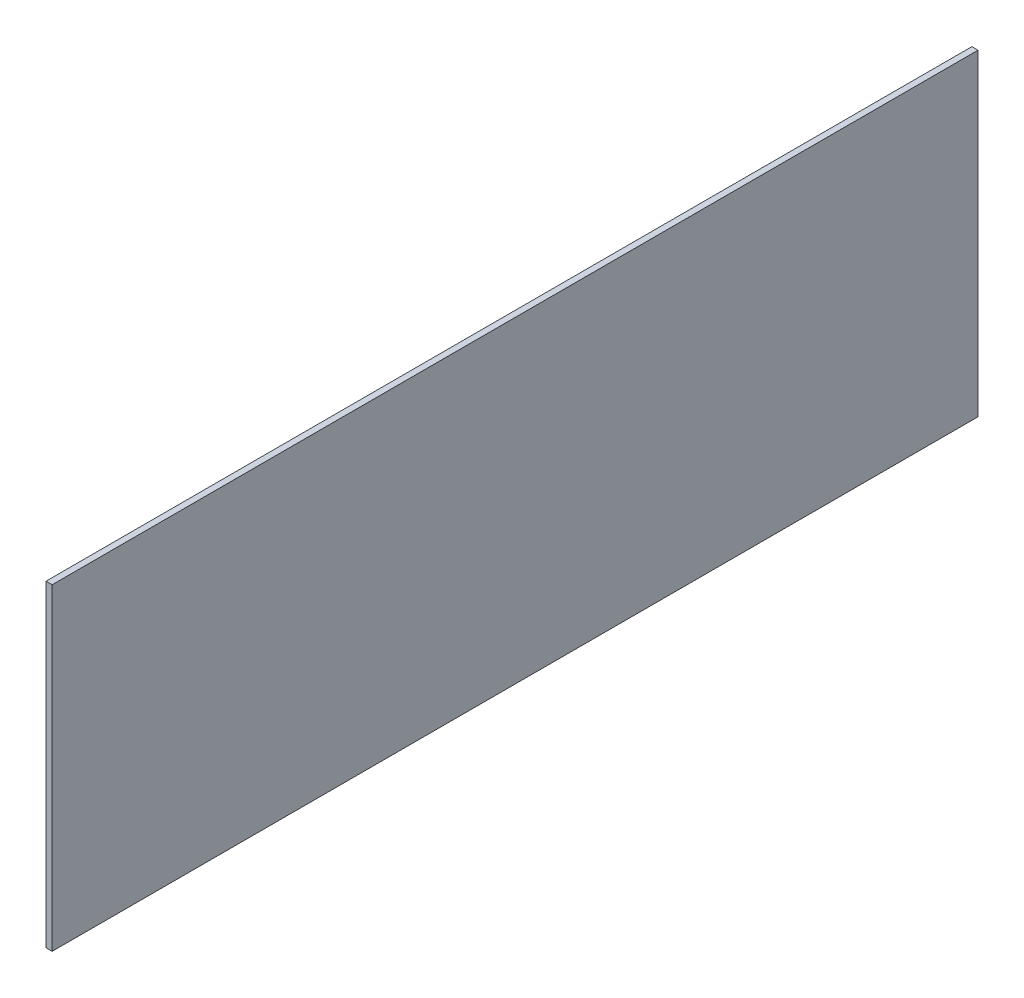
SolidWorks part; units mm, degrees
ref_plane "Alzado" through (0, 0, 0) normal (0, 0, 1) x (1, 0, 0)
ref_plane "Planta" through (0, 0, 0) normal (0, 1, 0) x (1, 0, 0)
ref_plane "Vista lateral" through (0, 0, 0) normal (1, 0, 0) x (0, 0, -1)
sketch "Sketch1" plane through (0, 0, 0) normal (1, 0, 0) x (0, 0, -1)
  line L1 (0, 0) -> (452, 0)
  line L2 (0, 0) -> (0, 155)
  line L3 (0, 155) -> (452, 155)
  line L4 (452, 0) -> (452, 155)
  dimension "D1" = 452
  dimension "D2" = 155
extrude "Boss-Extrude1" add sketch "Sketch1" along normal blind 3
